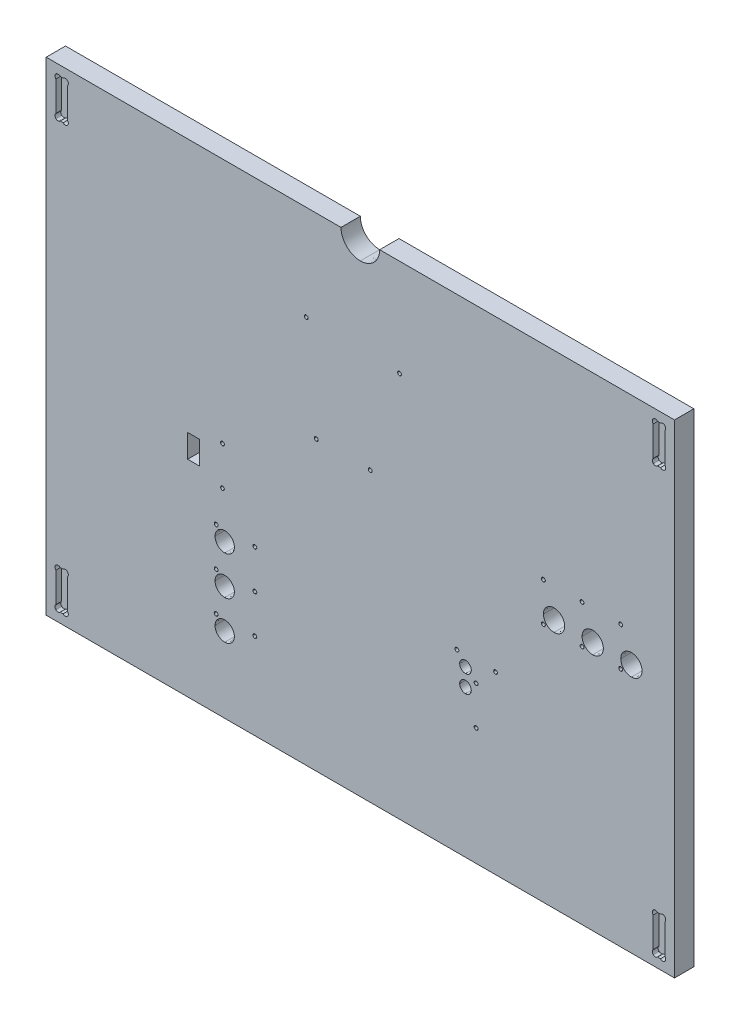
SolidWorks part; units mm, degrees
ref_plane "Plan de face" through (0, 0, 0) normal (0, 0, 1) x (1, 0, 0)
ref_plane "Plan de dessus" through (0, 0, 0) normal (0, 1, 0) x (1, 0, 0)
ref_plane "Plan de droite" through (0, 0, 0) normal (1, 0, 0) x (0, 0, -1)
sketch "Model" plane through (0, 0, 0) normal (0, 0, 1) x (1, 0, 0)
  line L16 (340.3586, 37.546) -> (187.859, 37.546)
  line L17 (167.8592, 37.546) -> (15.3596, 37.546)
  line L18 (15.3596, 37.546) -> (15.3596, -212.4539)
  line L19 (15.3596, -212.4539) -> (340.3586, -212.4539)
  line L20 (340.3586, -212.4539) -> (340.3586, 37.546)
  line L29 (88.5489, -105.9663) -> (94.5489, -105.9663)
  line L30 (94.5489, -105.9663) -> (94.5489, -93.9662)
  line L31 (94.5489, -93.9662) -> (88.5489, -93.9662)
  line L32 (88.5489, -93.9662) -> (88.5489, -105.9663)
  spline S0 degree 3 poles (112.7049, -173.3538) (112.7049, -170.5925) (110.4663, -168.3539) (107.7047, -168.3539) knots 0 0 0 0 1 1 1 1
  spline S1 degree 3 poles (107.7047, -168.3539) (104.9435, -168.3539) (102.7048, -170.5925) (102.7048, -173.3538) knots 1 1 1 1 2 2 2 2
  spline S2 degree 3 poles (102.7048, -173.3538) (102.7048, -176.1153) (104.9435, -178.354) (107.7047, -178.354) knots 2 2 2 2 3 3 3 3
  spline S3 degree 3 poles (107.7047, -178.354) (110.4663, -178.354) (112.7049, -176.1153) (112.7049, -173.3538) knots 3 3 3 3 4 4 4 4
  spline S4 degree 3 poles (112.7049, -153.3539) (112.7049, -150.5924) (110.4663, -148.3537) (107.7047, -148.3537) knots 0 0 0 0 1 1 1 1
  spline S5 degree 3 poles (107.7047, -148.3537) (104.9435, -148.3537) (102.7048, -150.5924) (102.7048, -153.3539) knots 1 1 1 1 2 2 2 2
  spline S6 degree 3 poles (102.7048, -153.3539) (102.7048, -156.1152) (104.9435, -158.3538) (107.7047, -158.3538) knots 2 2 2 2 3 3 3 3
  spline S7 degree 3 poles (107.7047, -158.3538) (110.4663, -158.3538) (112.7049, -156.1152) (112.7049, -153.3539) knots 3 3 3 3 4 4 4 4
  spline S8 degree 3 poles (112.7049, -133.3538) (112.7049, -130.5925) (110.4663, -128.3539) (107.7047, -128.3539) knots 0 0 0 0 1 1 1 1
  spline S9 degree 3 poles (107.7047, -128.3539) (104.9435, -128.3539) (102.7048, -130.5925) (102.7048, -133.3538) knots 1 1 1 1 2 2 2 2
  spline S10 degree 3 poles (102.7048, -133.3538) (102.7048, -136.1154) (104.9435, -138.3537) (107.7047, -138.3537) knots 2 2 2 2 3 3 3 3
  spline S11 degree 3 poles (107.7047, -138.3537) (110.4663, -138.3537) (112.7049, -136.1154) (112.7049, -133.3538) knots 3 3 3 3 4 4 4 4
  spline S12 degree 3 poles (323.5585, -83.2916) (323.5585, -80.254) (321.096, -77.7916) (318.0584, -77.7916) knots 0 0 0 0 1 1 1 1
  spline S13 degree 3 poles (318.0584, -77.7916) (315.0209, -77.7916) (312.5587, -80.254) (312.5587, -83.2916) knots 1 1 1 1 2 2 2 2
  spline S14 degree 3 poles (312.5587, -83.2916) (312.5587, -86.3291) (315.0209, -88.792) (318.0584, -88.792) knots 2 2 2 2 3 3 3 3
  spline S15 degree 3 poles (318.0584, -88.792) (321.096, -88.792) (323.5585, -86.3291) (323.5585, -83.2916) knots 3 3 3 3 4 4 4 4
  spline S16 degree 3 poles (303.5587, -83.2916) (303.5587, -80.254) (301.0962, -77.7916) (298.059, -77.7916) knots 0 0 0 0 1 1 1 1
  spline S17 degree 3 poles (298.059, -77.7916) (295.0211, -77.7916) (292.5585, -80.254) (292.5585, -83.2916) knots 1 1 1 1 2 2 2 2
  spline S18 degree 3 poles (292.5585, -83.2916) (292.5585, -86.3291) (295.0211, -88.792) (298.059, -88.792) knots 2 2 2 2 3 3 3 3
  spline S19 degree 3 poles (298.059, -88.792) (301.0962, -88.792) (303.5587, -86.3291) (303.5587, -83.2916) knots 3 3 3 3 4 4 4 4
  spline S20 degree 3 poles (283.5589, -83.2916) (283.5589, -80.254) (281.0964, -77.7916) (278.0588, -77.7916) knots 0 0 0 0 1 1 1 1
  spline S21 degree 3 poles (278.0588, -77.7916) (275.0213, -77.7916) (272.5591, -80.254) (272.5591, -83.2916) knots 1 1 1 1 2 2 2 2
  spline S22 degree 3 poles (272.5591, -83.2916) (272.5591, -86.3291) (275.0213, -88.792) (278.0588, -88.792) knots 2 2 2 2 3 3 3 3
  spline S23 degree 3 poles (278.0588, -88.792) (281.0964, -88.792) (283.5589, -86.3291) (283.5589, -83.2916) knots 3 3 3 3 4 4 4 4
  spline S120 degree 3 poles (187.859, 37.546) (187.859, 32.0232) (183.3821, 27.5459) (177.8593, 27.5459) knots 1 1 1 1 2 2 2 2
  spline S121 degree 3 poles (177.8593, 27.5459) (172.3364, 27.5459) (167.8592, 32.0232) (167.8592, 37.546) knots 2 2 2 2 3 3 3 3
  spline S122 degree 3 poles (235.2473, -127.1523) (235.2473, -125.4955) (233.9044, -124.1523) (232.2473, -124.1523) knots 0 0 0 0 1 1 1 1
  spline S123 degree 3 poles (232.2473, -124.1523) (230.5902, -124.1523) (229.2473, -125.4955) (229.2473, -127.1523) knots 1 1 1 1 2 2 2 2
  spline S124 degree 3 poles (229.2473, -127.1523) (229.2473, -128.8094) (230.5902, -130.1523) (232.2473, -130.1523) knots 2 2 2 2 3 3 3 3
  spline S125 degree 3 poles (232.2473, -130.1523) (233.9044, -130.1523) (235.2473, -128.8094) (235.2473, -127.1523) knots 3 3 3 3 4 4 4 4
  spline S134 degree 3 poles (107.56, -109.954) (107.56, -109.4014) (107.1122, -108.9539) (106.5602, -108.9539) knots 0 0 0 0 1 1 1 1
  spline S135 degree 3 poles (106.5602, -108.9539) (106.0077, -108.9539) (105.5601, -109.4014) (105.5601, -109.954) knots 1 1 1 1 2 2 2 2
  spline S136 degree 3 poles (105.5601, -109.954) (105.5601, -110.5063) (106.0077, -110.9538) (106.5602, -110.9538) knots 2 2 2 2 3 3 3 3
  spline S137 degree 3 poles (106.5602, -110.9538) (107.1122, -110.9538) (107.56, -110.5063) (107.56, -109.954) knots 3 3 3 3 4 4 4 4
  spline S138 degree 3 poles (107.56, -89.954) (107.56, -89.4018) (107.1122, -88.9541) (106.5602, -88.9541) knots 0 0 0 0 1 1 1 1
  spline S139 degree 3 poles (106.5602, -88.9541) (106.0077, -88.9541) (105.5601, -89.4018) (105.5601, -89.954) knots 1 1 1 1 2 2 2 2
  spline S140 degree 3 poles (105.5601, -89.954) (105.5601, -90.5063) (106.0077, -90.954) (106.5602, -90.954) knots 2 2 2 2 3 3 3 3
  spline S141 degree 3 poles (106.5602, -90.954) (107.1122, -90.954) (107.56, -90.5063) (107.56, -89.954) knots 3 3 3 3 4 4 4 4
  spline S142 degree 3 poles (232.2453, -139.1529) (233.9017, -139.1529) (235.2452, -137.81) (235.2452, -136.1529) knots 0 0 0 0 1 1 1 1
  spline S143 degree 3 poles (235.2452, -136.1529) (235.2452, -134.4958) (233.9017, -133.1529) (232.2453, -133.1529) knots 1 1 1 1 2 2 2 2
  spline S144 degree 3 poles (232.2453, -133.1529) (230.5882, -133.1529) (229.2453, -134.4958) (229.2453, -136.1529) knots 2 2 2 2 3 3 3 3
  spline S145 degree 3 poles (229.2453, -136.1529) (229.2453, -137.81) (230.5882, -139.1529) (232.2453, -139.1529) knots 3 3 3 3 4 4 4 4
extrude "Boss.-Extru.1" add sketch "Model" along normal blind 10
sketch "Esquisse2" plane through (0, 0, 10) normal (0, 0, 1) x (1, 0, 0)
  line L0 (333.0956, -207.4537) -> (331.6211, -207.4537)
  line L1 (329.3587, -205.1909) -> (329.3587, -189.7166)
  line L2 (331.6211, -187.4538) -> (333.0956, -187.4538)
  line L3 (335.3583, -189.7166) -> (335.3583, -205.1909)
  line L4 (22.6222, -187.4538) -> (24.0967, -187.4538)
  line L5 (26.3595, -189.7166) -> (26.3595, -205.1909)
  line L6 (24.0967, -207.4537) -> (22.6222, -207.4537)
  line L7 (20.3595, -205.1909) -> (20.3595, -189.7166)
  line L8 (22.6222, 32.5458) -> (24.0967, 32.5458)
  line L9 (26.3595, 30.2831) -> (26.3595, 14.8087)
  line L10 (24.0967, 12.546) -> (22.6222, 12.546)
  line L11 (20.3595, 14.8087) -> (20.3595, 30.2831)
  line L12 (333.0956, 12.546) -> (331.6211, 12.546)
  line L13 (329.3587, 14.8087) -> (329.3587, 30.2831)
  line L14 (331.6211, 32.5458) -> (333.0956, 32.5458)
  line L15 (335.3583, 30.2831) -> (335.3583, 14.8087)
  spline S24 degree 3 poles (331.6211, -207.4537) (330.9965, -208.0786) (329.9833, -208.0786) (329.3587, -207.4537) knots 1 1 1 1 2 2 2 2
  spline S25 degree 3 poles (329.3587, -207.4537) (328.7341, -206.8287) (328.7341, -205.8159) (329.3587, -205.1909) knots 2 2 2 2 3 3 3 3
  spline S26 degree 3 poles (329.3587, -189.7166) (328.7341, -189.0916) (328.7341, -188.0784) (329.3587, -187.4538) knots 4 4 4 4 5 5 5 5
  spline S27 degree 3 poles (329.3587, -187.4538) (329.9833, -186.8289) (330.9965, -186.8289) (331.6211, -187.4538) knots 5 5 5 5 6 6 6 6
  spline S28 degree 3 poles (333.0956, -187.4538) (333.7205, -186.8289) (334.7337, -186.8289) (335.3583, -187.4538) knots 7 7 7 7 8 8 8 8
  spline S29 degree 3 poles (335.3583, -187.4538) (335.9833, -188.0784) (335.9833, -189.0916) (335.3583, -189.7166) knots 8 8 8 8 9 9 9 9
  spline S30 degree 3 poles (335.3583, -205.1909) (335.9833, -205.8159) (335.9833, -206.8287) (335.3583, -207.4537) knots 10 10 10 10 11 11 11 11
  spline S31 degree 3 poles (335.3583, -207.4537) (334.7337, -208.0786) (333.7205, -208.0786) (333.0956, -207.4537) knots 11 11 11 11 12 12 12 12
  spline S32 degree 3 poles (24.0967, -187.4538) (24.7217, -186.8289) (25.7349, -186.8289) (26.3595, -187.4538) knots 1 1 1 1 2 2 2 2
  spline S33 degree 3 poles (26.3595, -187.4538) (26.9844, -188.0784) (26.9844, -189.0916) (26.3595, -189.7166) knots 2 2 2 2 3 3 3 3
  spline S34 degree 3 poles (26.3595, -205.1909) (26.9844, -205.8159) (26.9844, -206.8287) (26.3595, -207.4537) knots 4 4 4 4 5 5 5 5
  spline S35 degree 3 poles (26.3595, -207.4537) (25.7349, -208.0786) (24.7217, -208.0786) (24.0967, -207.4537) knots 5 5 5 5 6 6 6 6
  spline S36 degree 3 poles (22.6222, -207.4537) (21.9976, -208.0786) (20.9841, -208.0786) (20.3595, -207.4537) knots 7 7 7 7 8 8 8 8
  spline S37 degree 3 poles (20.3595, -207.4537) (19.7349, -206.8287) (19.7349, -205.8159) (20.3595, -205.1909) knots 8 8 8 8 9 9 9 9
  spline S38 degree 3 poles (20.3595, -189.7166) (19.7349, -189.0916) (19.7349, -188.0784) (20.3595, -187.4538) knots 10 10 10 10 11 11 11 11
  spline S39 degree 3 poles (20.3595, -187.4538) (20.9841, -186.8289) (21.9976, -186.8289) (22.6222, -187.4538) knots 11 11 11 11 12 12 12 12
  spline S40 degree 3 poles (24.0967, 32.5458) (24.7217, 33.1708) (25.7349, 33.1708) (26.3595, 32.5458) knots 1 1 1 1 2 2 2 2
  spline S41 degree 3 poles (26.3595, 32.5458) (26.9844, 31.9209) (26.9844, 30.908) (26.3595, 30.2831) knots 2 2 2 2 3 3 3 3
  spline S42 degree 3 poles (26.3595, 14.8087) (26.9844, 14.1838) (26.9844, 13.1706) (26.3595, 12.546) knots 4 4 4 4 5 5 5 5
  spline S43 degree 3 poles (26.3595, 12.546) (25.7349, 11.9211) (24.7217, 11.9211) (24.0967, 12.546) knots 5 5 5 5 6 6 6 6
  spline S44 degree 3 poles (22.6222, 12.546) (21.9976, 11.9211) (20.9841, 11.9211) (20.3595, 12.546) knots 7 7 7 7 8 8 8 8
  spline S45 degree 3 poles (20.3595, 12.546) (19.7349, 13.1706) (19.7349, 14.1838) (20.3595, 14.8087) knots 8 8 8 8 9 9 9 9
  spline S46 degree 3 poles (20.3595, 30.2831) (19.7349, 30.908) (19.7349, 31.9209) (20.3595, 32.5458) knots 10 10 10 10 11 11 11 11
  spline S47 degree 3 poles (20.3595, 32.5458) (20.9841, 33.1708) (21.9976, 33.1708) (22.6222, 32.5458) knots 11 11 11 11 12 12 12 12
  spline S48 degree 3 poles (331.6211, 12.546) (330.9965, 11.9211) (329.9833, 11.9211) (329.3587, 12.546) knots 1 1 1 1 2 2 2 2
  spline S49 degree 3 poles (329.3587, 12.546) (328.7341, 13.1706) (328.7341, 14.1838) (329.3587, 14.8087) knots 2 2 2 2 3 3 3 3
  spline S50 degree 3 poles (329.3587, 30.2831) (328.7341, 30.908) (328.7341, 31.9209) (329.3587, 32.5458) knots 4 4 4 4 5 5 5 5
  spline S51 degree 3 poles (329.3587, 32.5458) (329.9833, 33.1708) (330.9965, 33.1708) (331.6211, 32.5458) knots 5 5 5 5 6 6 6 6
  spline S52 degree 3 poles (333.0956, 32.5458) (333.7205, 33.1708) (334.7337, 33.1708) (335.3583, 32.5458) knots 7 7 7 7 8 8 8 8
  spline S53 degree 3 poles (335.3583, 32.5458) (335.9833, 31.9209) (335.9833, 30.908) (335.3583, 30.2831) knots 8 8 8 8 9 9 9 9
  spline S54 degree 3 poles (335.3583, 14.8087) (335.9833, 14.1838) (335.9833, 13.1706) (335.3583, 12.546) knots 10 10 10 10 11 11 11 11
  spline S55 degree 3 poles (335.3583, 12.546) (334.7337, 11.9211) (333.7205, 11.9211) (333.0956, 12.546) knots 11 11 11 11 12 12 12 12
  spline S56 degree 3 poles (313.5588, -67.9199) (313.5588, -67.3676) (313.1109, -66.9198) (312.5587, -66.9198) knots 0 0 0 0 1 1 1 1
  spline S57 degree 3 poles (312.5587, -66.9198) (312.0065, -66.9198) (311.5589, -67.3676) (311.5589, -67.9199) knots 1 1 1 1 2 2 2 2
  spline S58 degree 3 poles (311.5589, -67.9199) (311.5589, -68.4721) (312.0065, -68.9198) (312.5587, -68.9198) knots 2 2 2 2 3 3 3 3
  spline S59 degree 3 poles (312.5587, -68.9198) (313.1109, -68.9198) (313.5588, -68.4721) (313.5588, -67.9199) knots 3 3 3 3 4 4 4 4
  spline S60 degree 3 poles (313.5588, -87.9197) (313.5588, -87.3674) (313.1109, -86.9199) (312.5587, -86.9199) knots 0 0 0 0 1 1 1 1
  spline S61 degree 3 poles (312.5587, -86.9199) (312.0065, -86.9199) (311.5589, -87.3674) (311.5589, -87.9197) knots 1 1 1 1 2 2 2 2
  spline S62 degree 3 poles (311.5589, -87.9197) (311.5589, -88.4723) (312.0065, -88.9198) (312.5587, -88.9198) knots 2 2 2 2 3 3 3 3
  spline S63 degree 3 poles (312.5587, -88.9198) (313.1109, -88.9198) (313.5588, -88.4723) (313.5588, -87.9197) knots 3 3 3 3 4 4 4 4
  spline S64 degree 3 poles (293.5587, -67.9199) (293.5587, -67.3676) (293.1111, -66.9198) (292.5589, -66.9198) knots 0 0 0 0 1 1 1 1
  spline S65 degree 3 poles (292.5589, -66.9198) (292.0066, -66.9198) (291.5588, -67.3676) (291.5588, -67.9199) knots 1 1 1 1 2 2 2 2
  spline S66 degree 3 poles (291.5588, -67.9199) (291.5588, -68.4721) (292.0066, -68.9198) (292.5589, -68.9198) knots 2 2 2 2 3 3 3 3
  spline S67 degree 3 poles (292.5589, -68.9198) (293.1111, -68.9198) (293.5587, -68.4721) (293.5587, -67.9199) knots 3 3 3 3 4 4 4 4
  spline S68 degree 3 poles (293.5587, -87.9197) (293.5587, -87.3674) (293.1111, -86.9199) (292.5589, -86.9199) knots 0 0 0 0 1 1 1 1
  spline S69 degree 3 poles (292.5589, -86.9199) (292.0066, -86.9199) (291.5588, -87.3674) (291.5588, -87.9197) knots 1 1 1 1 2 2 2 2
  spline S70 degree 3 poles (291.5588, -87.9197) (291.5588, -88.4723) (292.0066, -88.9198) (292.5589, -88.9198) knots 2 2 2 2 3 3 3 3
  spline S71 degree 3 poles (292.5589, -88.9198) (293.1111, -88.9198) (293.5587, -88.4723) (293.5587, -87.9197) knots 3 3 3 3 4 4 4 4
  spline S72 degree 3 poles (273.5588, -67.9199) (273.5588, -67.3676) (273.111, -66.9198) (272.5587, -66.9198) knots 0 0 0 0 1 1 1 1
  spline S73 degree 3 poles (272.5587, -66.9198) (272.0065, -66.9198) (271.559, -67.3676) (271.559, -67.9199) knots 1 1 1 1 2 2 2 2
  spline S74 degree 3 poles (271.559, -67.9199) (271.559, -68.4721) (272.0065, -68.9198) (272.5587, -68.9198) knots 2 2 2 2 3 3 3 3
  spline S75 degree 3 poles (272.5587, -68.9198) (273.111, -68.9198) (273.5588, -68.4721) (273.5588, -67.9199) knots 3 3 3 3 4 4 4 4
  spline S76 degree 3 poles (273.5588, -87.9197) (273.5588, -87.3674) (273.111, -86.9199) (272.5587, -86.9199) knots 0 0 0 0 1 1 1 1
  spline S77 degree 3 poles (272.5587, -86.9199) (272.0065, -86.9199) (271.559, -87.3674) (271.559, -87.9197) knots 1 1 1 1 2 2 2 2
  spline S78 degree 3 poles (271.559, -87.9197) (271.559, -88.4723) (272.0065, -88.9198) (272.5587, -88.9198) knots 2 2 2 2 3 3 3 3
  spline S79 degree 3 poles (272.5587, -88.9198) (273.111, -88.9198) (273.5588, -88.4723) (273.5588, -87.9197) knots 3 3 3 3 4 4 4 4
  spline S80 degree 3 poles (124.2946, -167.8537) (124.2946, -167.3014) (123.8467, -166.8536) (123.2945, -166.8536) knots 0 0 0 0 1 1 1 1
  spline S81 degree 3 poles (123.2945, -166.8536) (122.7422, -166.8536) (122.2943, -167.3014) (122.2943, -167.8537) knots 1 1 1 1 2 2 2 2
  spline S82 degree 3 poles (122.2943, -167.8537) (122.2943, -168.4059) (122.7422, -168.8538) (123.2945, -168.8538) knots 2 2 2 2 3 3 3 3
  spline S83 degree 3 poles (123.2945, -168.8538) (123.8467, -168.8538) (124.2946, -168.4059) (124.2946, -167.8537) knots 3 3 3 3 4 4 4 4
  spline S84 degree 3 poles (104.2944, -167.8537) (104.2944, -167.3014) (103.8469, -166.8536) (103.2946, -166.8536) knots 0 0 0 0 1 1 1 1
  spline S85 degree 3 poles (103.2946, -166.8536) (102.742, -166.8536) (102.2945, -167.3014) (102.2945, -167.8537) knots 1 1 1 1 2 2 2 2
  spline S86 degree 3 poles (102.2945, -167.8537) (102.2945, -168.4059) (102.742, -168.8538) (103.2946, -168.8538) knots 2 2 2 2 3 3 3 3
  spline S87 degree 3 poles (103.2946, -168.8538) (103.8469, -168.8538) (104.2944, -168.4059) (104.2944, -167.8537) knots 3 3 3 3 4 4 4 4
  spline S88 degree 3 poles (124.2946, -147.8539) (124.2946, -147.3013) (123.8467, -146.8537) (123.2945, -146.8537) knots 0 0 0 0 1 1 1 1
  spline S89 degree 3 poles (123.2945, -146.8537) (122.7422, -146.8537) (122.2943, -147.3013) (122.2943, -147.8539) knots 1 1 1 1 2 2 2 2
  spline S90 degree 3 poles (122.2943, -147.8539) (122.2943, -148.4061) (122.7422, -148.8536) (123.2945, -148.8536) knots 2 2 2 2 3 3 3 3
  spline S91 degree 3 poles (123.2945, -148.8536) (123.8467, -148.8536) (124.2946, -148.4061) (124.2946, -147.8539) knots 3 3 3 3 4 4 4 4
  spline S92 degree 3 poles (104.2944, -147.8539) (104.2944, -147.3013) (103.8469, -146.8537) (103.2946, -146.8537) knots 0 0 0 0 1 1 1 1
  spline S93 degree 3 poles (103.2946, -146.8537) (102.742, -146.8537) (102.2945, -147.3013) (102.2945, -147.8539) knots 1 1 1 1 2 2 2 2
  spline S94 degree 3 poles (102.2945, -147.8539) (102.2945, -148.4061) (102.742, -148.8536) (103.2946, -148.8536) knots 2 2 2 2 3 3 3 3
  spline S95 degree 3 poles (103.2946, -148.8536) (103.8469, -148.8536) (104.2944, -148.4061) (104.2944, -147.8539) knots 3 3 3 3 4 4 4 4
  spline S96 degree 3 poles (124.2946, -127.8537) (124.2946, -127.3014) (123.8467, -126.8536) (123.2945, -126.8536) knots 0 0 0 0 1 1 1 1
  spline S97 degree 3 poles (123.2945, -126.8536) (122.7422, -126.8536) (122.2943, -127.3014) (122.2943, -127.8537) knots 1 1 1 1 2 2 2 2
  spline S98 degree 3 poles (122.2943, -127.8537) (122.2943, -128.4059) (122.7422, -128.8538) (123.2945, -128.8538) knots 2 2 2 2 3 3 3 3
  spline S99 degree 3 poles (123.2945, -128.8538) (123.8467, -128.8538) (124.2946, -128.4059) (124.2946, -127.8537) knots 3 3 3 3 4 4 4 4
  spline S100 degree 3 poles (104.2944, -127.8537) (104.2944, -127.3014) (103.8469, -126.8536) (103.2946, -126.8536) knots 0 0 0 0 1 1 1 1
  spline S101 degree 3 poles (103.2946, -126.8536) (102.742, -126.8536) (102.2945, -127.3014) (102.2945, -127.8537) knots 1 1 1 1 2 2 2 2
  spline S102 degree 3 poles (102.2945, -127.8537) (102.2945, -128.4059) (102.742, -128.8538) (103.2946, -128.8538) knots 2 2 2 2 3 3 3 3
  spline S103 degree 3 poles (103.2946, -128.8538) (103.8469, -128.8538) (104.2944, -128.4059) (104.2944, -127.8537) knots 3 3 3 3 4 4 4 4
  spline S104 degree 3 poles (150.859, -11.6541) (150.859, -11.1018) (150.4115, -10.654) (149.8592, -10.654) knots 0 0 0 0 1 1 1 1
  spline S105 degree 3 poles (149.8592, -10.654) (149.307, -10.654) (148.8591, -11.1018) (148.8591, -11.6541) knots 1 1 1 1 2 2 2 2
  spline S106 degree 3 poles (148.8591, -11.6541) (148.8591, -12.2063) (149.307, -12.6542) (149.8592, -12.6542) knots 2 2 2 2 3 3 3 3
  spline S107 degree 3 poles (149.8592, -12.6542) (150.4115, -12.6542) (150.859, -12.2063) (150.859, -11.6541) knots 3 3 3 3 4 4 4 4
  spline S108 degree 3 poles (156.059, -63.654) (156.059, -63.1017) (155.6115, -62.6541) (155.0593, -62.6541) knots 0 0 0 0 1 1 1 1
  spline S109 degree 3 poles (155.0593, -62.6541) (154.507, -62.6541) (154.0592, -63.1017) (154.0592, -63.654) knots 1 1 1 1 2 2 2 2
  spline S110 degree 3 poles (154.0592, -63.654) (154.0592, -64.2062) (154.507, -64.6541) (155.0593, -64.6541) knots 2 2 2 2 3 3 3 3
  spline S111 degree 3 poles (155.0593, -64.6541) (155.6115, -64.6541) (156.059, -64.2062) (156.059, -63.654) knots 3 3 3 3 4 4 4 4
  spline S112 degree 3 poles (199.1592, -12.7541) (199.1592, -12.2018) (198.7114, -11.754) (198.1591, -11.754) knots 0 0 0 0 1 1 1 1
  spline S113 degree 3 poles (198.1591, -11.754) (197.6069, -11.754) (197.159, -12.2018) (197.159, -12.7541) knots 1 1 1 1 2 2 2 2
  spline S114 degree 3 poles (197.159, -12.7541) (197.159, -13.3063) (197.6069, -13.7542) (198.1591, -13.7542) knots 2 2 2 2 3 3 3 3
  spline S115 degree 3 poles (198.1591, -13.7542) (198.7114, -13.7542) (199.1592, -13.3063) (199.1592, -12.7541) knots 3 3 3 3 4 4 4 4
  spline S116 degree 3 poles (183.9591, -63.654) (183.9591, -63.1017) (183.5113, -62.6541) (182.959, -62.6541) knots 0 0 0 0 1 1 1 1
  spline S117 degree 3 poles (182.959, -62.6541) (182.4068, -62.6541) (181.9593, -63.1017) (181.9593, -63.654) knots 1 1 1 1 2 2 2 2
  spline S118 degree 3 poles (181.9593, -63.654) (181.9593, -64.2062) (182.4068, -64.6541) (182.959, -64.6541) knots 2 2 2 2 3 3 3 3
  spline S119 degree 3 poles (182.959, -64.6541) (183.5113, -64.6541) (183.9591, -64.2062) (183.9591, -63.654) knots 3 3 3 3 4 4 4 4
  spline S124 degree 3 poles (248.8234, -121.6529) (248.8234, -121.1006) (248.3755, -120.6531) (247.8233, -120.6531) knots 0 0 0 0 1 1 1 1
  spline S125 degree 3 poles (247.8233, -120.6531) (247.271, -120.6531) (246.8235, -121.1006) (246.8235, -121.6529) knots 1 1 1 1 2 2 2 2
  spline S126 degree 3 poles (246.8235, -121.6529) (246.8235, -122.2055) (247.271, -122.653) (247.8233, -122.653) knots 2 2 2 2 3 3 3 3
  spline S127 degree 3 poles (247.8233, -122.653) (248.3755, -122.653) (248.8234, -122.2055) (248.8234, -121.6529) knots 3 3 3 3 4 4 4 4
  spline S128 degree 3 poles (228.8232, -121.6529) (228.8232, -121.1006) (228.3757, -120.6531) (227.8235, -120.6531) knots 0 0 0 0 1 1 1 1
  spline S129 degree 3 poles (227.8235, -120.6531) (227.2712, -120.6531) (226.8234, -121.1006) (226.8234, -121.6529) knots 1 1 1 1 2 2 2 2
  spline S130 degree 3 poles (226.8234, -121.6529) (226.8234, -122.2055) (227.2712, -122.653) (227.8235, -122.653) knots 2 2 2 2 3 3 3 3
  spline S131 degree 3 poles (227.8235, -122.653) (228.3757, -122.653) (228.8232, -122.2055) (228.8232, -121.6529) knots 3 3 3 3 4 4 4 4
  spline S144 degree 3 poles (237.7443, -152.729) (238.2969, -152.729) (238.7441, -152.2811) (238.7441, -151.7289) knots 0 0 0 0 1 1 1 1
  spline S145 degree 3 poles (238.7441, -151.7289) (238.7441, -151.1766) (238.2969, -150.7291) (237.7443, -150.7291) knots 1 1 1 1 2 2 2 2
  spline S146 degree 3 poles (237.7443, -150.7291) (237.1917, -150.7291) (236.7446, -151.1766) (236.7446, -151.7289) knots 2 2 2 2 3 3 3 3
  spline S147 degree 3 poles (236.7446, -151.7289) (236.7446, -152.2811) (237.1917, -152.729) (237.7443, -152.729) knots 3 3 3 3 4 4 4 4
  spline S148 degree 3 poles (237.7443, -132.7288) (238.2969, -132.7288) (238.7441, -132.2813) (238.7441, -131.7291) knots 0 0 0 0 1 1 1 1
  spline S149 degree 3 poles (238.7441, -131.7291) (238.7441, -131.1768) (238.2969, -130.729) (237.7443, -130.729) knots 1 1 1 1 2 2 2 2
  spline S150 degree 3 poles (237.7443, -130.729) (237.1917, -130.729) (236.7446, -131.1768) (236.7446, -131.7291) knots 2 2 2 2 3 3 3 3
  spline S151 degree 3 poles (236.7446, -131.7291) (236.7446, -132.2813) (237.1917, -132.7288) (237.7443, -132.7288) knots 3 3 3 3 4 4 4 4
extrude "Enlèv. mat.-Extru.1" cut sketch "Esquisse2" against normal blind 3
